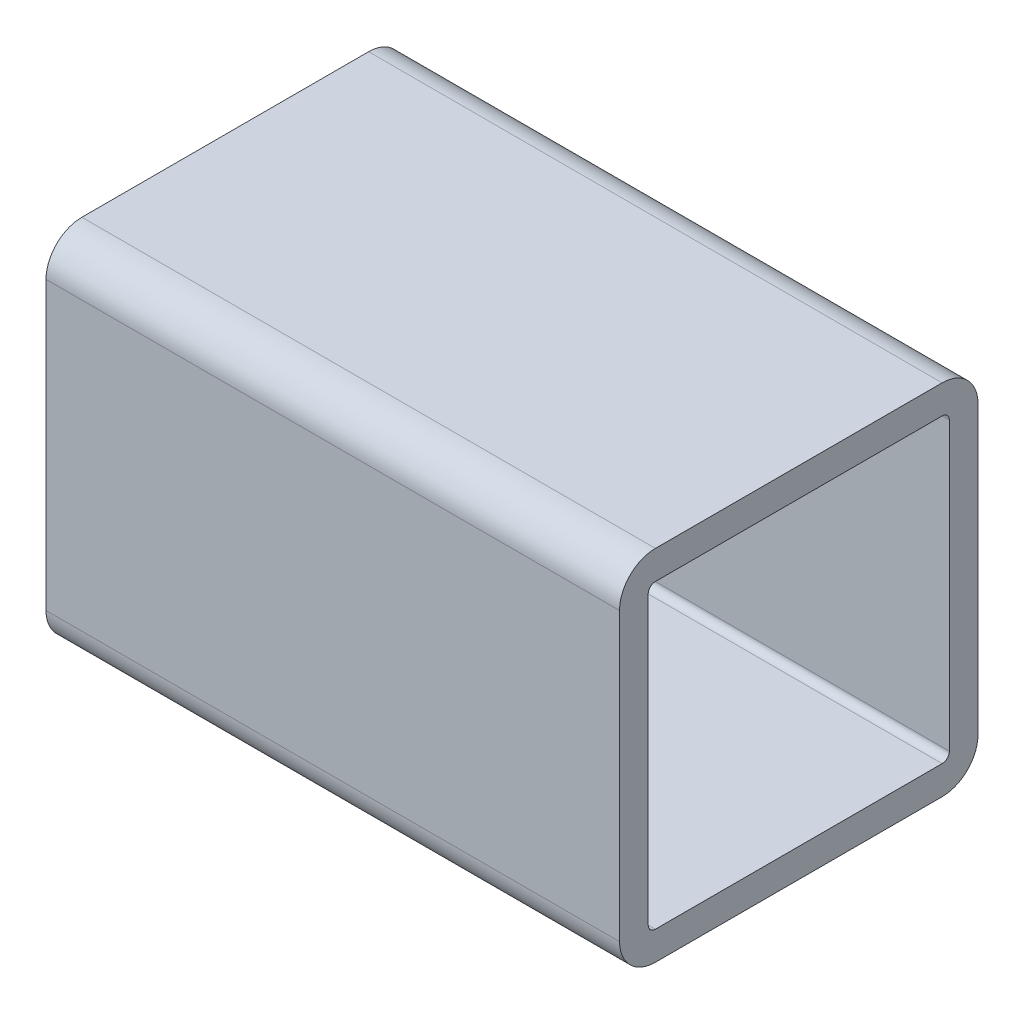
SolidWorks part; units mm, degrees
ref_plane "Plan de face" through (0, 0, 0) normal (0, 0, 1) x (1, 0, 0)
ref_plane "Plan de dessus" through (0, 0, 0) normal (0, 1, 0) x (1, 0, 0)
ref_plane "Plan de droite" through (0, 0, 0) normal (1, 0, 0) x (0, 0, -1)
sketch "Esquisse1" plane through (0, 0, 0) normal (1, 0, 0) x (0, 0, -1)
  line L0 (-10, 10.5) -> (10, 10.5)
  line L1 (-10, 12.5) -> (10, 12.5)
  line L2 (-12.5, 10) -> (-12.5, -10)
  line L3 (-10, -12.5) -> (10, -12.5)
  line L4 (12.5, 10) -> (12.5, -10)
  line L5 (-12.5, 12.5) -> (12.5, -12.5) construction
  line L6 (-12.5, -12.5) -> (12.5, 12.5) construction
  line L7 (10.5, 10) -> (10.5, -10)
  line L8 (-10, -10.5) -> (10, -10.5)
  line L9 (-10.5, 10) -> (-10.5, -10)
  arc A0 (-12.5, -10) -> (-10, -12.5) centre (-10, -10) ccw
  arc A1 (10, -12.5) -> (12.5, -10) centre (10, -10) ccw
  arc A2 (10, 12.5) -> (12.5, 10) centre (10, 10) cw
  arc A3 (-10, 12.5) -> (-12.5, 10) centre (-10, 10) ccw
  arc A4 (10, 10.5) -> (10.5, 10) centre (10, 10) cw
  arc A5 (10, -10.5) -> (10.5, -10) centre (10, -10) ccw
  arc A6 (-10.5, -10) -> (-10, -10.5) centre (-10, -10) ccw
  arc A7 (-10, 10.5) -> (-10.5, 10) centre (-10, 10) ccw
  point P0 (0, 0)
  dimension "D2" = 2.5
  dimension "D1" = 25
  dimension "D3" = 2
extrude "Boss.-Extru.1" add sketch "Esquisse1" along normal blind 40
